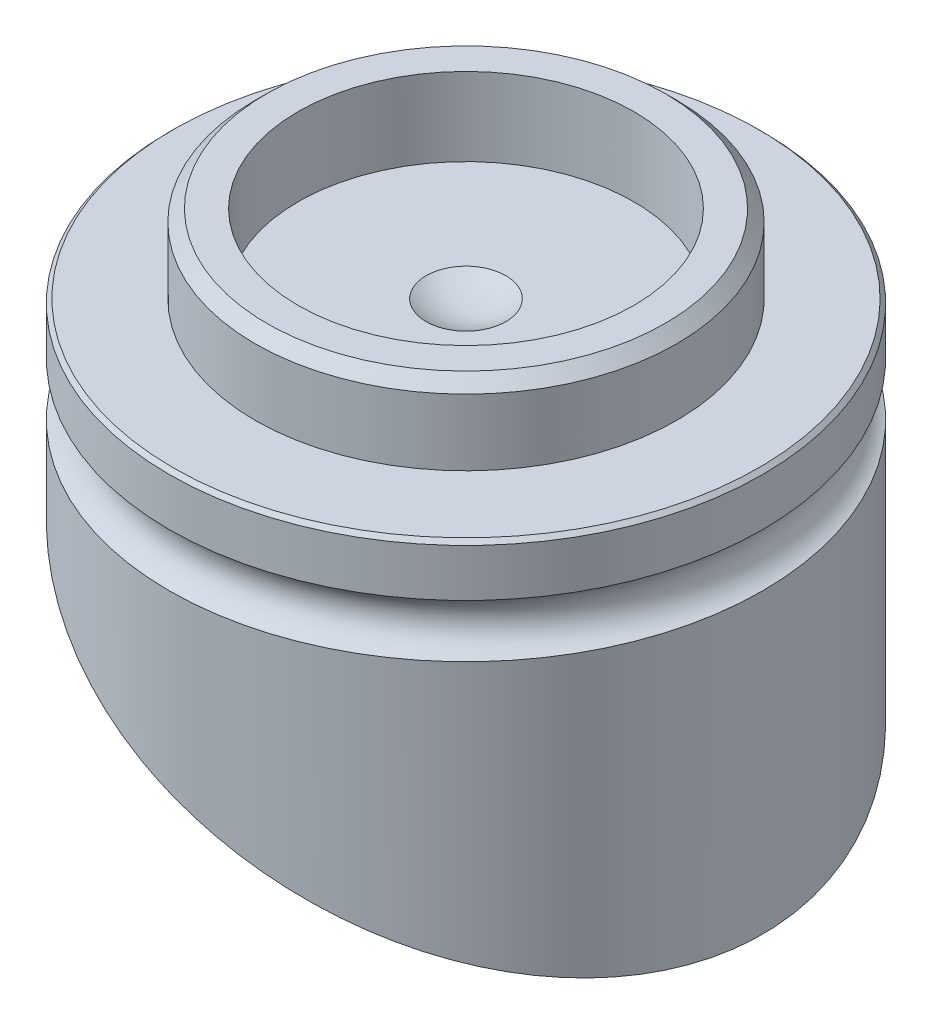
SolidWorks part; units mm, degrees
ref_plane "Plan de face" through (0, 0, 0) normal (0, 0, 1) x (1, 0, 0)
ref_plane "Plan de dessus" through (0, 0, 0) normal (0, 1, 0) x (1, 0, 0)
ref_plane "Plan de droite" through (0, 0, 0) normal (1, 0, 0) x (0, 0, -1)
sketch "Esquisse1" plane through (0, 0, 0) normal (0, 1, 0) x (1, 0, 0)
  line L1 (-20, -20) -> (20, -20)
  line L2 (-20, -20) -> (-20, 20)
  line L3 (-20, 20) -> (20, 20)
  line L4 (20, -20) -> (20, 20)
  line L5 (-20, -20) -> (20, 20) construction
  line L6 (-20, 20) -> (20, -20) construction
  point P0 (0, 0)
  dimension "D1" = 40
  dimension "D2" = 40
extrude "Boss.-Extru.1" add sketch "Esquisse1" along normal blind 50
sketch "Esquisse2" plane through (0, 50, 0) normal (0, 1, 0) x (-1, 0, 0)
  circle A0 centre (0, 0) radius 19
  circle A1 centre (0, 0) radius 28.2843
  dimension "D1" = 38
extrude "Enlèv. mat.-Extru.1" cut sketch "Esquisse2" against normal through all
sketch "Esquisse3" plane through (0, 50, 0) normal (0, 1, 0) x (-1, 0, 0)
  circle A0 centre (0, 0) radius 10.75
  dimension "D1" = 21.5
extrude "Enlèv. mat.-Extru.3" cut sketch "Esquisse3" against normal blind 15
sketch "Esquisse4" plane through (0, 50, 0) normal (0, 1, 0) x (-1, 0, 0)
  circle A0 centre (0, 0) radius 13.5
  circle A1 centre (0, 0) radius 19
  dimension "D1" = 27
  dimension "D2" = 38
extrude "Enlèv. mat.-Extru.4" cut sketch "Esquisse4" against normal blind 15
sketch "Esquisse5" plane through (0, 0, 0) normal (0, 0, 1) x (1, 0, 0)
  line L0 (0, 0) -> (0, 43.9346) construction
  line L1 (0, 34.3) -> (0, 44.3)
  line L2 (19, 35) -> (-19, 35) construction
  arc A0 (0, 44.3) -> (0, 34.3) centre (0, 39.3) ccw
  dimension "D1" = 10
  dimension "D2" = 0.7
revolve "Enlèvement de matière-Révolution1" cut sketch "Esquisse5" angle 360 about L0
chamfer "Chanfrein3" distance 0.25 angle 45 2 edges at (0, 35, 19) (0, 50, 10.75)
sketch "Esquisse8" plane through (0, 0, 0) normal (0, 0, 1) x (1, 0, 0)
  line L1 (0, 0) -> (0, 58.4833) construction
  line L3 (-17.8, 30) -> (0, 30) construction
  circle A0 centre (-19.6, 30) radius 1.8
  dimension "D1" = 3.6
  dimension "D2" = 30
  dimension "D3" = 35.6
revolve "Enlèvement de matière-Révolution2" cut sketch "Esquisse8" angle 360 about L1
sketch "Esquisse6" plane through (0, 0, 0) normal (0, 0, 1) x (1, 0, 0)
  line L0 (-19, 25) -> (19, 9.2599)
  line L1 (19, 0) -> (19, 9.2599)
  line L3 (19, 0) -> (-19, 0)
  line L4 (-19, 0) -> (19, 0) construction
  line L6 (-19, 0) -> (-19, 25)
  line L7 (18.75, 35) -> (-18.75, 35) construction
  line L8 (-19, 28.3029) -> (-19, 0) construction
  line L9 (19, 0) -> (19, 28.3029) construction
  dimension "D1" = 10
  dimension "D2" = 22.5
extrude "Enlèv. mat.-Extru.5" cut sketch "Esquisse6" against normal mid plane 45
hole_wizard "Trou taraudé M6x1.01" positions "Esquisse10" profile "Esquisse9" tap size "M6x1.0" standard "Ansi Métrique"
sketch "Esquisse10" plane through (6.0563, 14.6213, 0) normal (-0.3827, -0.9239, 0) x (0.9239, -0.3827, 0)
  ellipse E0 centre (-6.5553, 0) end of major axis (-27.1208, 0) minor radius 19 construction
  point P0 (-6.5553, 0)
sketch "Esquisse9" plane through (0, 17.1299, 0) normal (0, 0, 1) x (0.9239, -0.3827, 0)
  line L0 (0, 0) -> (0, 18.5022)
  line L1 (0, 18.5022) -> (2.5, 17)
  line L2 (2.5, 17) -> (2.5, 0)
  line L5 (2.5, 0) -> (0, 0)
  line L10 (0, 18.5022) -> (-2.5, 17) construction
  line L11 (0, -6.35) -> (0, 107.95) construction
  dimension "Diamètre du trou pour taraudage" = 5
  dimension "Profondeur du trou pour taraudage" = 17
  dimension "Angle de pointe" = 118
sketch "Esquisse11" plane through (0, 0, 0) normal (0, 0, 1) x (1, 0, 0)
  line L0 (0, 0) -> (0, 34.3) construction
  arc A0 (-2.5515, 35) -> (2.5515, 35) centre (0, 39.3) ccw construction
ref_plane "Plan1" through (0, 34.3, 0) normal (0, 1, 0) x (-1, 0, 0)
ref_point "Point1"
sketch "Esquisse12" plane through (0, 0, 0) normal (0, 0, 1) x (1, 0, 0)
  line L0 (13.5, 35) -> (13.5, 50) construction
  line L1 (-13.5, 50) -> (13.5, 50)
  line L2 (-13.5, 50) -> (-13.5, 40)
  line L3 (-13.5, 40) -> (13.5, 40)
  line L4 (13.5, 50) -> (13.5, 40)
  line L5 (18.75, 35) -> (-18.75, 35) construction
  dimension "D1" = 5
extrude "Enlèv. mat.-Extru.6" cut sketch "Esquisse12" against normal mid plane 30
chamfer "Chanfrein4" distance 0.75 angle 45 1 edges at (0, 40, -13.5)
ref_plane "Plan2" through (0, 29.9, 0) normal (0, 1, 0) x (-1, 0, 0)
